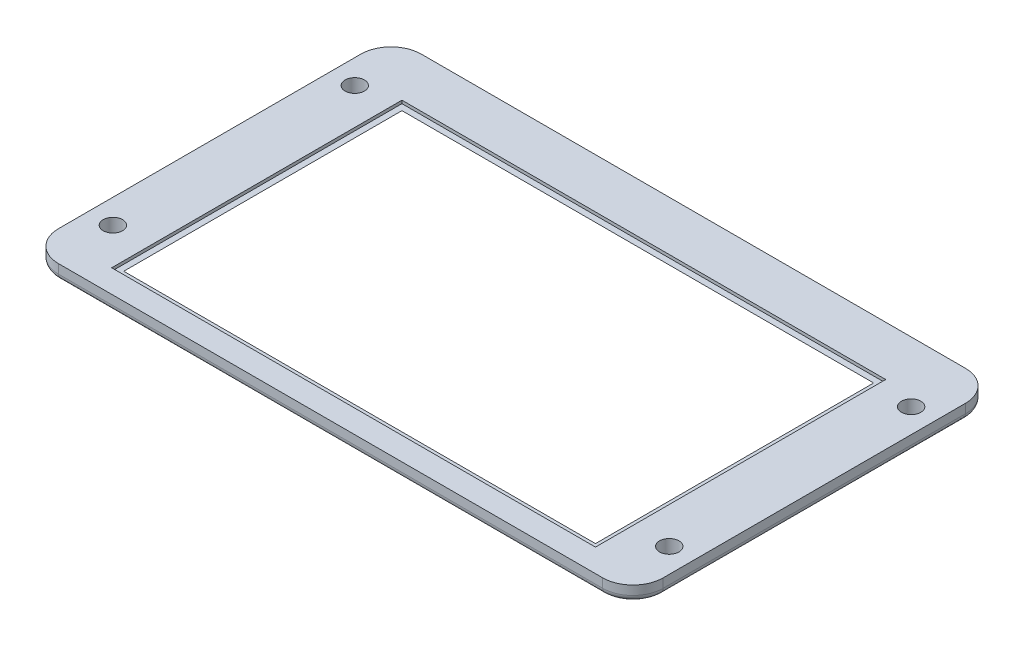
SolidWorks part; units mm, degrees
ref_plane "Front Plane" through (0, 0, 0) normal (0, 0, 1) x (1, 0, 0)
ref_plane "Top Plane" through (0, 0, 0) normal (0, 1, 0) x (1, 0, 0)
ref_plane "Right Plane" through (0, 0, 0) normal (1, 0, 0) x (0, 0, -1)
sketch "Sketch1" plane through (0, 0, 0) normal (0, 1, 0) x (1, 0, 0)
  line L0 (0, 0) -> (0, 137.1855) construction
  line L1 (0, 0) -> (127, 0)
  line L2 (0, 0) -> (0, 76.2)
  line L3 (0, 76.2) -> (127, 76.2)
  line L4 (127, 0) -> (127, 76.2)
  dimension "D1" = 127
  dimension "D2" = 76.2
extrude "Boss-Extrude1" add sketch "Sketch1" along normal blind 3.175
sketch "Sketch2" plane through (0, 3.175, 0) normal (0, 1, 0) x (1, 0, 0)
  line L1 (13.97, 6.096) -> (113.03, 6.096)
  line L2 (13.97, 6.096) -> (13.97, 64.516)
  line L3 (13.97, 64.516) -> (113.03, 64.516)
  line L4 (113.03, 6.096) -> (113.03, 64.516)
  line L5 (63.5, 0) -> (63.5, 91.8383) construction
  line L6 (0, 0) -> (127, 0) construction
  line L7 (63.5, 64.516) -> (63.5, 116.2748) construction
  line L8 (0, 0) -> (127, 0) construction
  line L9 (0, 38.1) -> (-43.1019, 38.1) construction
  line L10 (0, 76.2) -> (0, 0) construction
  dimension "D1" = 58.42
  dimension "D2" = 99.06
  dimension "D3" = 6.096
sketch "Sketch5" plane through (0, 3.175, 0) normal (0, 1, 0) x (1, 0, 0)
  line L0 (0, 63.5) -> (140.5457, 63.5) construction
  line L1 (0, 76.2) -> (0, 0) construction
  line L2 (0, 12.7) -> (146.5137, 12.7) construction
  line L3 (127, 76.2) -> (0, 76.2) construction
  line L4 (0, 0) -> (127, 0) construction
  line L5 (127, 0) -> (127, 76.2) construction
  circle A0 centre (5.08, 63.5) radius 2.032
  circle A1 centre (5.08, 12.7) radius 2.032
  circle A2 centre (121.92, 63.5) radius 2.032
  circle A3 centre (121.92, 12.7) radius 2.032
  dimension "D3" = 4.064
  dimension "D4" = 4.064
  dimension "D5" = 4.064
  dimension "D6" = 4.064
  dimension "D1" = 12.7
  dimension "D2" = 12.7
  dimension "D7" = 5.08
  dimension "D8" = 5.08
  dimension "D9" = 5.08
  dimension "D10" = 5.08
extrude "Cut-Extrude4" cut sketch "Sketch5" against normal through all
fillet "Fillet1" radius 6.35 4 edges at (127, 1.5875, 0) (0, 1.5875, 0) (127, 1.5875, -76.2) (0, 1.5875, -76.2)
extrude "Cut-Extrude5" cut sketch "Sketch2" against normal through all
sketch "Sketch6" plane through (0, 3.175, 0) normal (0, 1, 0) x (1, 0, 0)
  line L0 (127, 38.1) -> (154.5227, 38.1) construction
  line L5 (127, 6.35) -> (127, 69.85) construction
  line L7 (63.5, 3.556) -> (63.5, -32.1335) construction
  line L8 (113.03, 6.096) -> (113.03, 64.516) construction
  line L11 (12.7, 4.826) -> (114.3, 4.826)
  line L12 (12.7, 4.826) -> (12.7, 65.786)
  line L13 (12.7, 65.786) -> (114.3, 65.786)
  line L14 (114.3, 4.826) -> (114.3, 65.786)
  line L15 (113.03, 64.516) -> (13.97, 64.516) construction
  dimension "D1" = 1.27
  dimension "D7" = 1.27
chamfer "Chamfer1" distance 2.54 angle 45 4 edges at (13.97, 0, -35.306) (63.5, 0, -6.096) (113.03, 0, -35.306) (63.5, 0, -64.516)
extrude "Cut-Extrude6" cut sketch "Sketch6" against normal blind 0.635
fillet "Fillet2" radius 1.27 8 edges at (125.1401, 0, -1.8599) (127, 0, -38.1) (125.1401, 0, -74.3401) (63.5, 0, -76.2) (1.8599, 0, -74.3401) (0, 0, -38.1) (1.8599, 0, -1.8599) (63.5, 0, 0)
